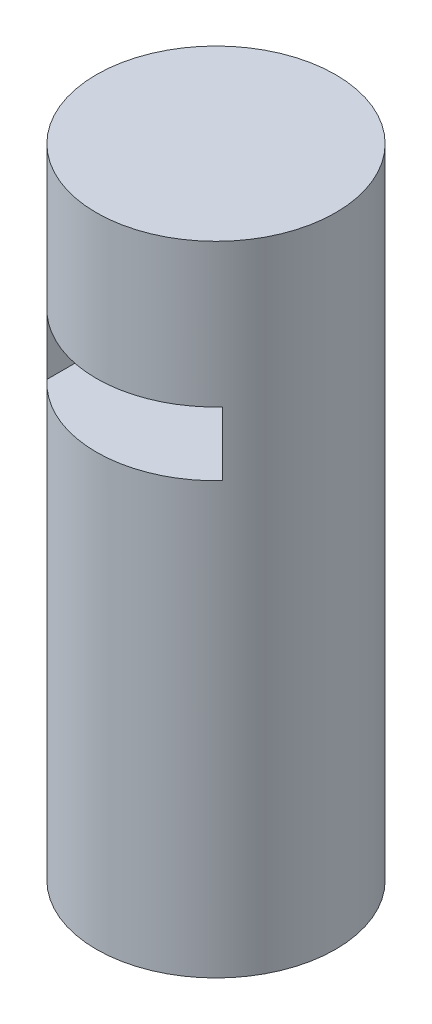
SolidWorks part; units mm, degrees
ref_plane "Front Plane" through (0, 0, 0) normal (0, 0, 1) x (1, 0, 0)
ref_plane "Top Plane" through (0, 0, 0) normal (0, 1, 0) x (1, 0, 0)
ref_plane "Right Plane" through (0, 0, 0) normal (1, 0, 0) x (0, 0, -1)
sketch "Sketch1" plane through (0, 0, 0) normal (0, 1, 0) x (1, 0, 0)
  circle A0 centre (-14.2271, -3.8582) radius 9.525
extrude "Boss-Extrude3" add sketch "Sketch1" along normal blind 39.37
sketch "Sketch4" plane through (0, 39.37, 0) normal (0, 1, 0) x (1, 0, 0)
  line L1 (-21.2121, 6.3018) -> (-7.2421, 6.3018)
  line L2 (-21.2121, 6.3018) -> (-21.2121, -14.0182)
  line L3 (-21.2121, -14.0182) -> (-7.2421, -14.0182)
  line L4 (-7.2421, 6.3018) -> (-7.2421, -14.0182)
  circle A0 centre (-14.2271, -3.8582) radius 9.525 construction
  dimension "D1" = 6.985
  dimension "D2" = 10.16
  dimension "D3" = 13.97
extrude "Cut-Extrude1" cut sketch "Sketch4" against normal blind 5.08
sketch "Sketch5" plane through (0, 39.37, 0) normal (0, 1, 0) x (1, 0, 0)
  circle A0 centre (-14.2271, -3.8582) radius 9.525
  arc A1 (-7.2421, -10.3339) -> (-7.2421, 2.6176) centre (-14.2271, -3.8582) ccw construction
  dimension "D1" = 0
extrude "Boss-Extrude4" add sketch "Sketch5" along normal blind 11.43
